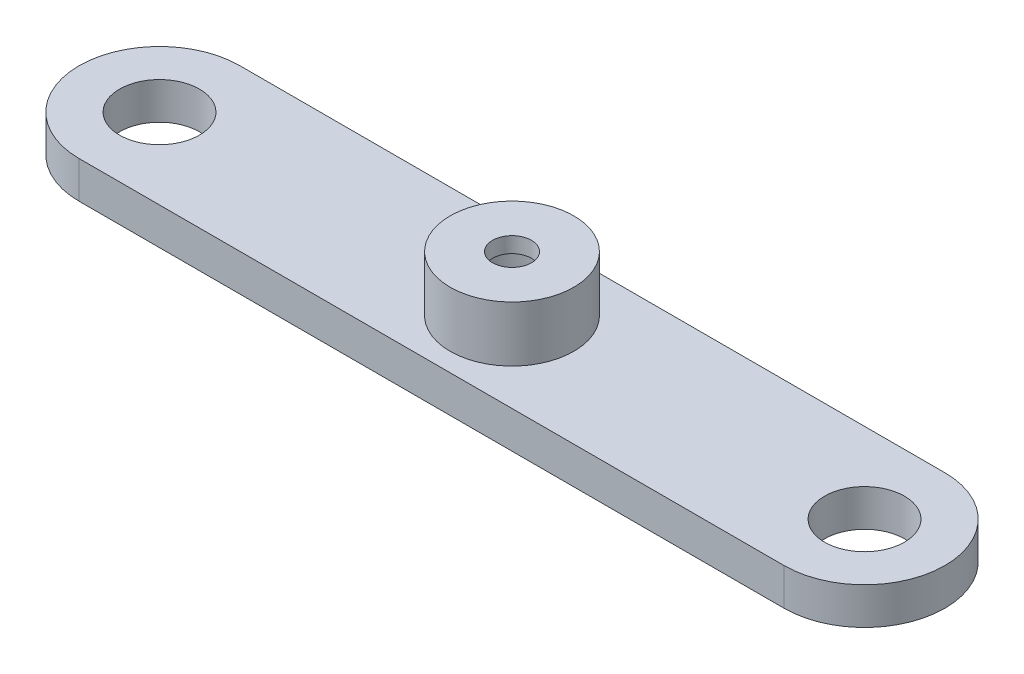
SolidWorks part; units mm, degrees
ref_plane "Front Plane" through (0, 0, 0) normal (0, 0, 1) x (1, 0, 0)
ref_plane "Top Plane" through (0, 0, 0) normal (0, 1, 0) x (1, 0, 0)
ref_plane "Right Plane" through (0, 0, 0) normal (1, 0, 0) x (0, 0, -1)
sketch "Sketch1" plane through (0, 0, 0) normal (0, 1, 0) x (1, 0, 0)
  circle A0 centre (0, 0) radius 2.4486
  circle A3 centre (0, 0) radius 3.175
  dimension "D1" = 4.8971
  dimension "D2" = 6.35
extrude "Boss-Extrude1" add sketch "Sketch1" along normal blind 3.95
sketch "Sketch6" plane through (0, 3.95, 0) normal (0, 1, 0) x (1, 0, 0)
  circle A0 centre (0, 0) radius 3.175
  circle A1 centre (0, 0) radius 1
  circle A2 centre (0, 0) radius 3.175 construction
  dimension "D1" = 2
extrude "Boss-Extrude3" add sketch "Sketch6" along normal blind 0.8
sketch "Sketch7" plane through (0, 0, 0) normal (0, 1, 0) x (1, 0, 0)
  line L0 (18.0975, 0) -> (-18.0975, 0) construction
  line L1 (18.0975, -4.1275) -> (-18.0975, -4.1275)
  line L2 (18.0975, 4.1275) -> (-18.0975, 4.1275)
  arc A0 (18.0975, -4.1275) -> (18.0975, 4.1275) centre (18.0975, 0) ccw
  arc A1 (-18.0975, 4.1275) -> (-18.0975, -4.1275) centre (-18.0975, 0) ccw
  circle A2 centre (0, 0) radius 3.175
  circle A3 centre (-18.0975, 0) radius 2.05
  circle A4 centre (18.0975, 0) radius 2.05
  circle A5 centre (0, 0) radius 3.175 construction
  point P2 (0, 0)
  point P11 (-22.225, 0)
  point P12 (22.225, 0)
  dimension "D3" = 4.1
  dimension "D4" = 4.1
  dimension "D1" = 8.255
  dimension "D2" = 44.45
extrude "Boss-Extrude4" add sketch "Sketch7" along normal blind 1.9
